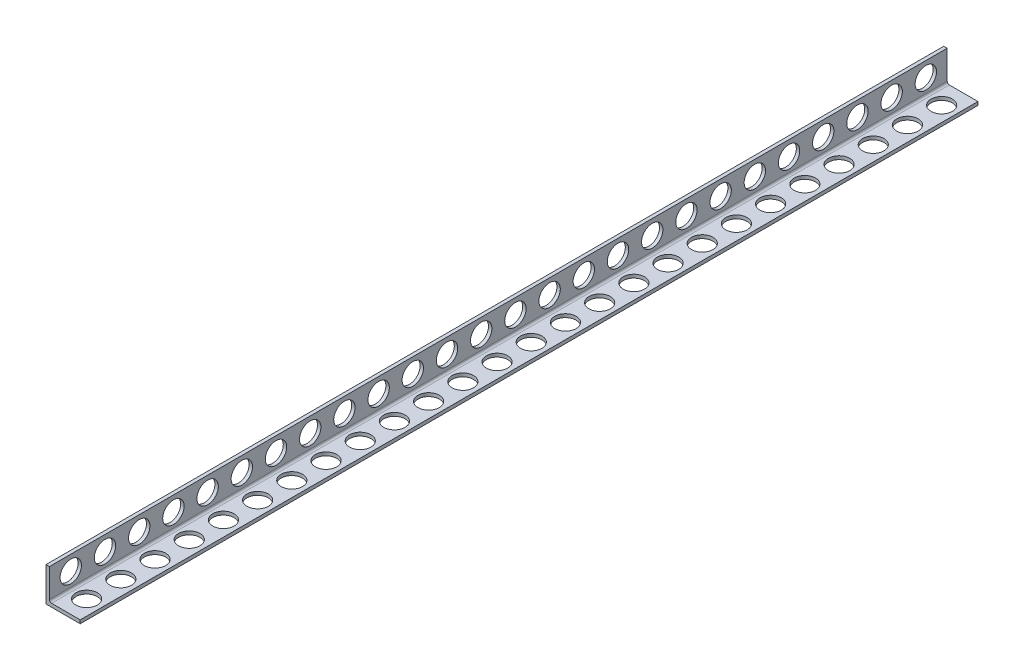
SolidWorks part; units mm, degrees
ref_plane "Front" through (0, 0, 0) normal (0, 0, 1) x (1, 0, 0)
ref_plane "Top" through (0, 0, 0) normal (0, 1, 0) x (1, 0, 0)
ref_plane "Right" through (0, 0, 0) normal (1, 0, 0) x (0, 0, -1)
sketch "Sketch1" plane through (0, 0, 0) normal (0, 0, 1) x (1, 0, 0)
  line L0 (-58.6206, 0) -> (89.271, 0) construction
  line L1 (0, 113.9997) -> (0, -36.1686) construction
  line L2 (-40, 0) -> (40, 0)
  line L3 (-32, 8) -> (40, 8)
  line L4 (-40, 80) -> (-40, 0)
  line L6 (40, 8) -> (40, 0)
  line L11 (-40, 80) -> (-32, 80)
  line L12 (-32, 80) -> (-32, 8)
  dimension "D1" = 80
  dimension "D2" = 40
  dimension "D4" = 8
  dimension "D5" = 8
  dimension "D6" = 80
extrude "Extrude1" add sketch "Sketch1" along normal mid plane 2100
fillet "Fillet1" radius 5 1 edges at (-32, 8, 0)
sketch "Sketch2" plane through (-40, 0, 0) normal (-1, 0, 0) x (0, 0, 1)
  line L0 (1050, 80) -> (-1050, 80) construction
  line L1 (-1050, 80) -> (-1050, 0) construction
  circle A0 centre (-1000, 45) radius 25
  dimension "D1" = 50
  dimension "D2" = 35
  dimension "D3" = 50
extrude "Cut-Extrude1" cut sketch "Sketch2" against normal through all
sketch "Sketch3" plane through (0, 8, 0) normal (0, 1, 0) x (-1, 0, 0)
  line L0 (32, -1000) -> (40, -1000) construction
  line L2 (-40, 1050) -> (-40, -1050) construction
  circle A0 centre (-5, -1000) radius 25
  dimension "D1" = 50
  dimension "D2" = 35
extrude "Cut-Extrude2" cut sketch "Sketch3" against normal through all
pattern_linear "LPattern1" count 26 spacing 80 along (0, 0, 1) of "Cut-Extrude1", "Cut-Extrude2"
equation "\"D1@Extrude1\" = \"D1@LPattern1\" * \"D3@LPattern1\"+20"
